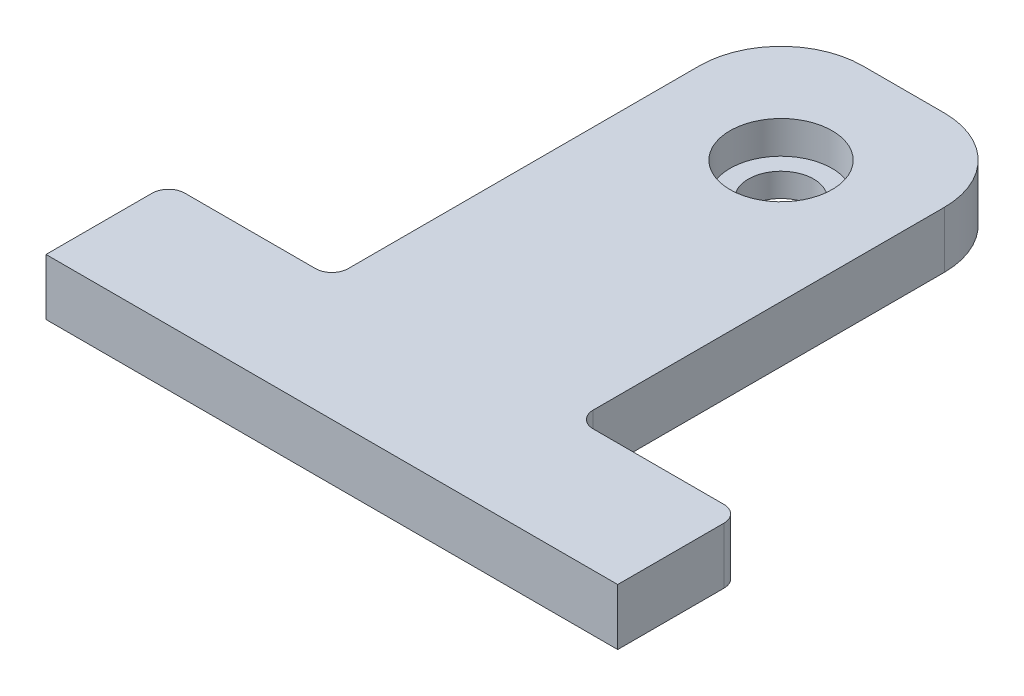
SolidWorks part; units mm, degrees
ref_plane "Front Plane" through (0, 0, 0) normal (0, 0, 1) x (1, 0, 0)
ref_plane "Top Plane" through (0, 0, 0) normal (0, 1, 0) x (1, 0, 0)
ref_plane "Right Plane" through (0, 0, 0) normal (1, 0, 0) x (0, 0, -1)
sketch "Sketch1" plane through (0, 0, 0) normal (0, 1, 0) x (1, 0, 0)
  line L0 (0, 0) -> (88.9, 0)
  line L1 (88.9, 0) -> (88.9, 16.51)
  line L2 (86.36, 19.05) -> (66.04, 19.05)
  line L3 (63.5, 21.59) -> (63.5, 76.2)
  line L4 (50.8, 88.9) -> (38.1, 88.9)
  line L5 (25.4, 76.2) -> (25.4, 21.59)
  line L6 (22.86, 19.05) -> (2.54, 19.05)
  line L7 (0, 16.51) -> (0, 0)
  circle A0 centre (44.45, 69.85) radius 5.08
  arc A1 (66.04, 19.05) -> (63.5, 21.59) centre (66.04, 21.59) cw
  arc A2 (25.4, 21.59) -> (22.86, 19.05) centre (22.86, 21.59) cw
  arc A3 (88.9, 16.51) -> (86.36, 19.05) centre (86.36, 16.51) ccw
  arc A4 (2.54, 19.05) -> (0, 16.51) centre (2.54, 16.51) ccw
  arc A5 (63.5, 76.2) -> (50.8, 88.9) centre (50.8, 76.2) ccw
  arc A6 (38.1, 88.9) -> (25.4, 76.2) centre (38.1, 76.2) ccw
  point P13 (63.5, 19.05)
  point P16 (25.4, 19.05)
  point P19 (88.9, 19.05)
  point P22 (0, 19.05)
  dimension "D7" = 19.05
  dimension "D9" = 2.54
  dimension "D10" = 12.7
  dimension "D1" = 88.9
  dimension "D2" = 25.4
  dimension "D3" = 25.4
  dimension "D4" = 69.85
  dimension "D5" = 44.45
  dimension "D6" = 88.9
  dimension "D8" = 19.05
extrude "Boss-Extrude1" add sketch "Sketch1" along normal blind 8.763
sketch "Sketch2" plane through (0, 8.763, 0) normal (0, 1, 0) x (1, 0, 0)
  circle A0 centre (44.45, 69.85) radius 7.9375
extrude "Cut-Extrude1" cut sketch "Sketch2" against normal blind 5.08
